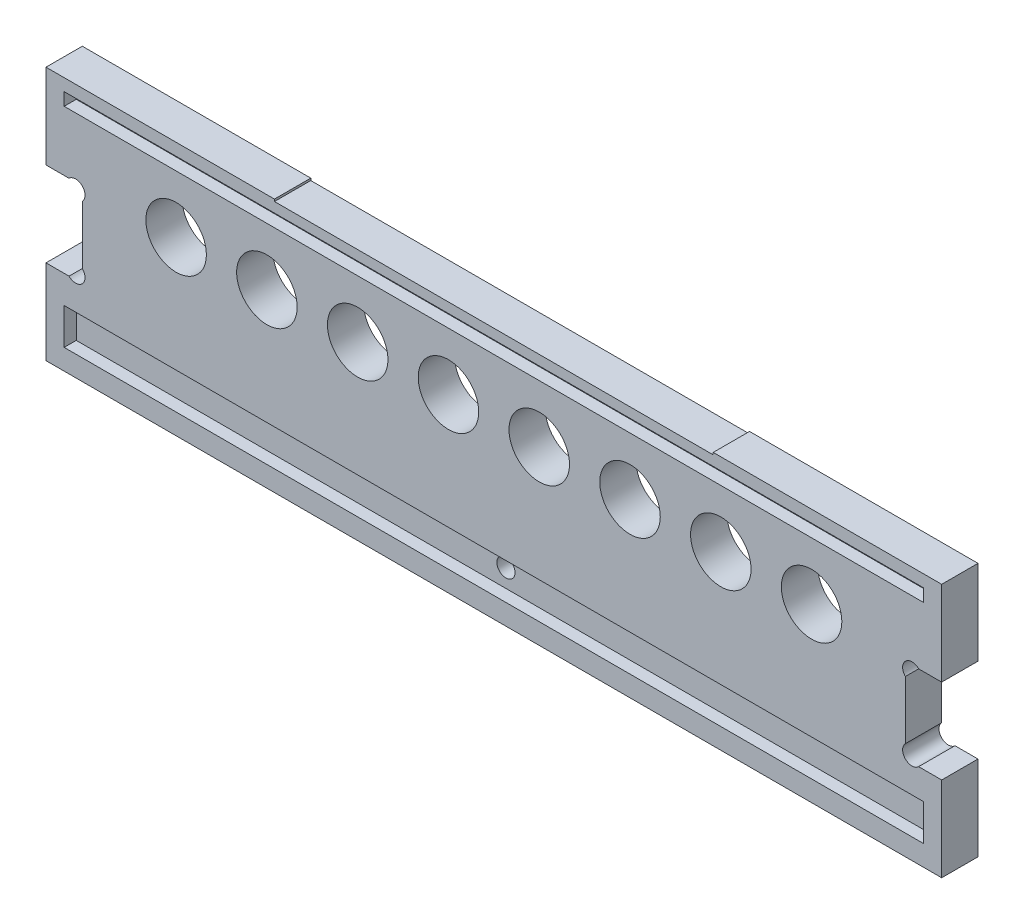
SolidWorks part; units mm, degrees
ref_plane "Plan de face" through (0, 0, 0) normal (0, 0, 1) x (1, 0, 0)
ref_plane "Plan de dessus" through (0, 0, 0) normal (0, 1, 0) x (1, 0, 0)
ref_plane "Plan de droite" through (0, 0, 0) normal (1, 0, 0) x (0, 0, -1)
sketch "Esquisse1" plane through (0, 0, 0) normal (0, 0, 1) x (1, 0, 0)
  line L0 (-18.4854, 0) -> (174.0371, 0) construction
  line L1 (0, -14.575) -> (0, 70.5052) construction
  line L2 (-18.4854, 42) -> (174.0371, 42) construction
  line L3 (-49.4967, 21) -> (232.5709, 21) construction
  line L4 (6, 65.2215) -> (6, -6.5783) construction
  line L5 (-6.1176, 9.4) -> (153.5283, 9.4) construction
  line L6 (-6.1176, 3.4) -> (153.5309, 3.4) construction
  line L7 (141.5, 56.6286) -> (141.5, -12.2812) construction
  line L8 (-7.2936, 37.9) -> (161.4629, 37.9) construction
  line L9 (-7.2936, 40) -> (161.4629, 40) construction
  line L10 (142, 56.6286) -> (142, -3.0419) construction
  line L11 (148, 70.5052) -> (148, -14.575) construction
  line L12 (74, 61.2759) -> (74, -18.1878) construction
  line L13 (6.2304, 24.4) -> (145.746, 24.4) construction
  line L14 (0, 42) -> (37.75, 42)
  line L15 (6.5, 15.8677) -> (6.5, 70.5052) construction
  line L16 (0, 42) -> (0, 28)
  line L17 (0, 0) -> (148, 0)
  line L18 (148, 42) -> (148, 28)
  line L19 (21.5, 30.0552) -> (21.5, 18.1829) construction
  line L20 (16.4844, 28.4) -> (139.4014, 28.4) construction
  line L21 (36.5, 30.0552) -> (36.5, 18.1829) construction
  line L22 (51.5, 30.0552) -> (51.5, 18.1829) construction
  line L23 (66.5, 30.0552) -> (66.5, 18.1829) construction
  line L24 (81.5, 30.0552) -> (81.5, 18.1829) construction
  line L25 (96.5, 30.0552) -> (96.5, 18.1829) construction
  line L26 (111.5, 30.0552) -> (111.5, 18.1829) construction
  line L27 (126.5, 30.0552) -> (126.5, 18.1829) construction
  line L28 (-9.5964, 28) -> (7.661, 28) construction
  line L29 (6, 28) -> (-0.7151, 21.2849) construction
  line L30 (0, 28) -> (3.808, 28)
  line L31 (0, 14) -> (3.808, 14)
  line L32 (6, 25.808) -> (6, 16.192)
  line L33 (0, 14) -> (0, 0)
  line L34 (148, 14) -> (144.192, 14)
  line L35 (142, 25.808) -> (142, 16.192)
  line L36 (148, 28) -> (144.192, 28)
  line L37 (148, 14) -> (148, 0)
  line L38 (37.75, 56.6286) -> (37.75, 38.8192) construction
  line L39 (110.25, 56.6286) -> (110.25, 38.8192) construction
  line L40 (16.4844, 41.65) -> (133.5022, 41.65) construction
  line L41 (-7.2936, 6.4) -> (158.0721, 6.4) construction
  line L42 (110.25, 42) -> (110.25, 41.65)
  line L43 (37.75, 41.65) -> (37.75, 42)
  line L44 (37.75, 41.65) -> (110.25, 41.65)
  line L45 (110.25, 42) -> (148, 42)
  circle A0 centre (74, 6.3976) radius 1.5
  circle A1 centre (21.5, 28.4) radius 5
  circle A2 centre (36.5, 28.4) radius 5
  circle A3 centre (51.5, 28.4) radius 5
  circle A4 centre (66.5, 28.4) radius 5
  circle A5 centre (81.5, 28.4) radius 5
  circle A6 centre (96.5, 28.4) radius 5
  circle A7 centre (111.5, 28.4) radius 5
  circle A8 centre (126.5, 28.4) radius 5
  arc A9 (6, 25.808) -> (3.808, 28) centre (4.904, 26.904) ccw
  arc A10 (6, 16.192) -> (3.808, 14) centre (4.904, 15.096) cw
  arc A11 (142, 16.192) -> (144.192, 14) centre (143.096, 15.096) ccw
  arc A12 (142, 25.808) -> (144.192, 28) centre (143.096, 26.904) cw
  dimension "D10" = 15
  dimension "D12" = 7
  dimension "D14" = 0.35
  dimension "D16" = 3
  dimension "D17" = 36.25
  dimension "D6" = 15
  dimension "D11" = 4
  dimension "D2" = 0.5
  dimension "D3" = 135
  dimension "D4" = 0.5
  dimension "D5" = 6
  dimension "D7" = 2
  dimension "D8" = 6
  dimension "D9" = 2.1
  dimension "D13" = 45
  dimension "D15" = 36.25
extrude "Extrusion1" add sketch "Esquisse1" along normal blind 6
sketch "Esquisse2" plane through (0, 0, 6) normal (0, 0, 1) x (1, 0, 0)
  line L0 (-3.4366, 3.4) -> (153.5234, 3.4) construction
  line L1 (-3.4366, 9.4) -> (153.5234, 9.4) construction
  line L2 (-3.4366, 37.9) -> (153.5234, 37.9) construction
  line L3 (-3.4366, 40) -> (153.5234, 40) construction
  line L4 (3, 49.9286) -> (3, -10.6391) construction
  line L5 (145, 46.2854) -> (145, -3.201) construction
  line L6 (0, 45.2228) -> (0, -3.201) construction
  line L7 (148, 45.2228) -> (148, -5.9334) construction
  line L8 (-5.4366, 42) -> (149.5966, 42) construction
  line L9 (149.5966, 0) -> (-3.4366, 0) construction
  line L11 (3, 40) -> (145, 40)
  line L12 (3, 40) -> (3, 37.9)
  line L13 (3, 37.9) -> (145, 37.9)
  line L14 (145, 40) -> (145, 37.9)
  line L15 (3, 9.4) -> (145, 9.4)
  line L16 (3, 9.4) -> (3, 3.4)
  line L17 (3, 3.4) -> (145, 3.4)
  line L18 (145, 9.4) -> (145, 3.4)
  dimension "D1" = 3
  dimension "D2" = 3.4
  dimension "D3" = 6
  dimension "D4" = 2
  dimension "D5" = 2.1
  dimension "D6" = 3
extrude "Enlèv. mat.-Extru.1" cut sketch "Esquisse2" against normal blind 2
